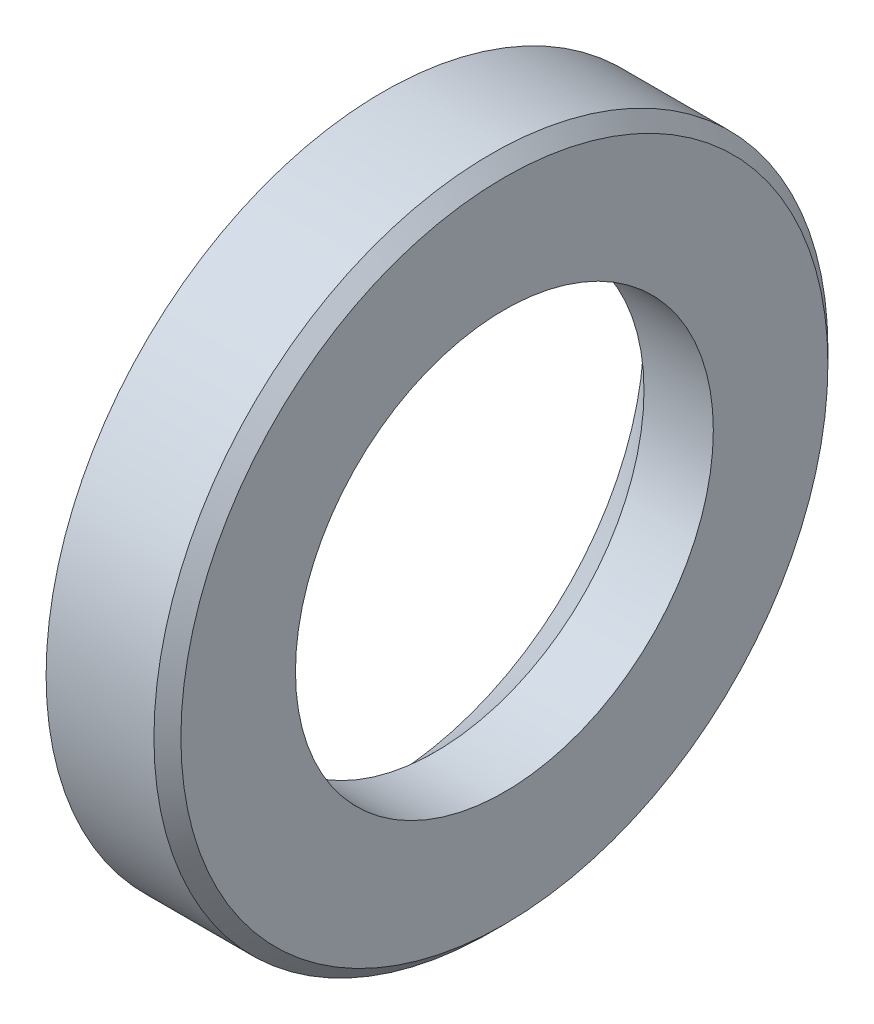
SolidWorks part; units mm, degrees
ref_plane "Face" through (0, 0, 0) normal (0, 0, 1) x (1, 0, 0)
ref_plane "Dessus" through (0, 0, 0) normal (0, 1, 0) x (1, 0, 0)
ref_plane "Droite" through (0, 0, 0) normal (1, 0, 0) x (0, 0, -1)
sketch "Esquisse1" plane through (0, 0, 0) normal (0, 0, 1) x (1, 0, 0)
  line L0 (2, -5.25) -> (2, 0.75) construction
  line L1 (2.3, 0.85) -> (2.3, 2.75)
  line L2 (1.2713, 0.85) -> (0.5, 1.6213)
  line L3 (0.5, 1.6213) -> (0.5, 2.75)
  line L4 (0.5, 2.75) -> (2.3, 2.75)
  line L7 (2.747, -2.25) -> (1.1219, -2.25) construction
  line L8 (11.299, -2.25) -> (1.299, -2.25) construction
  line L9 (2, 0.85) -> (-5.3, 0.85)
  line L10 (2.3, 0.85) -> (1.2713, 0.85)
  circle A0 centre (0, 0) radius 1.5 construction
  dimension "D1" = 45
  dimension "D2" = 5
  dimension "D3" = 0.3
  dimension "D5" = 1.8
  dimension "D6" = 0.1
revolve "Base-Révolution" add sketch "Esquisse1" angle 360 about L7
chamfer "Chanfrein1" distance 0.2 angle 45
